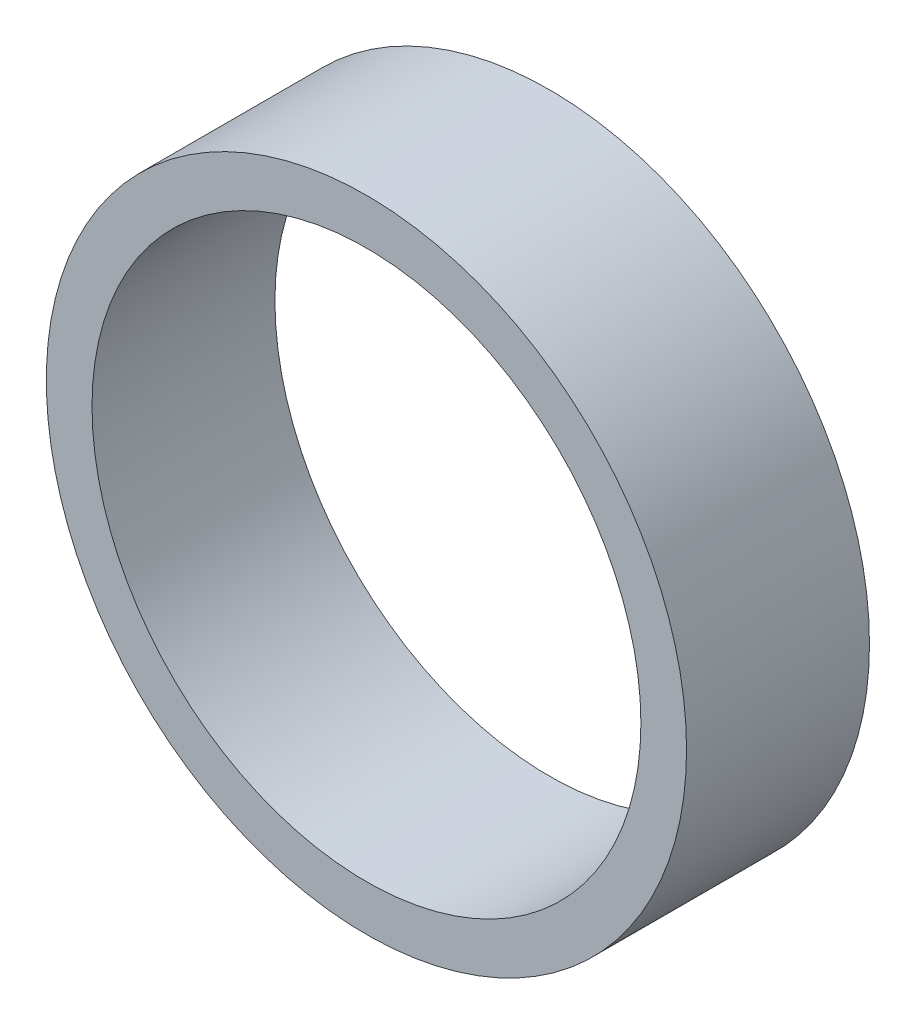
SolidWorks part; units mm, degrees
ref_plane "Front Plane" through (0, 0, 0) normal (0, 0, 1) x (1, 0, 0)
ref_plane "Top Plane" through (0, 0, 0) normal (0, 1, 0) x (1, 0, 0)
ref_plane "Right Plane" through (0, 0, 0) normal (1, 0, 0) x (0, 0, -1)
sketch "Sketch1" plane through (0, 0, 0) normal (0, 0, 1) x (1, 0, 0)
  circle A0 centre (0, 0) radius 133.35
extrude "Boss-Extrude1" add sketch "Sketch1" along normal blind 76.2
sketch "Sketch2" plane through (0, 0, 0) normal (0, 0, 1) x (1, 0, 0)
  circle A0 centre (0, 0) radius 114.3254
extrude "Cut-Extrude1" cut sketch "Sketch2" along normal blind 76.2
